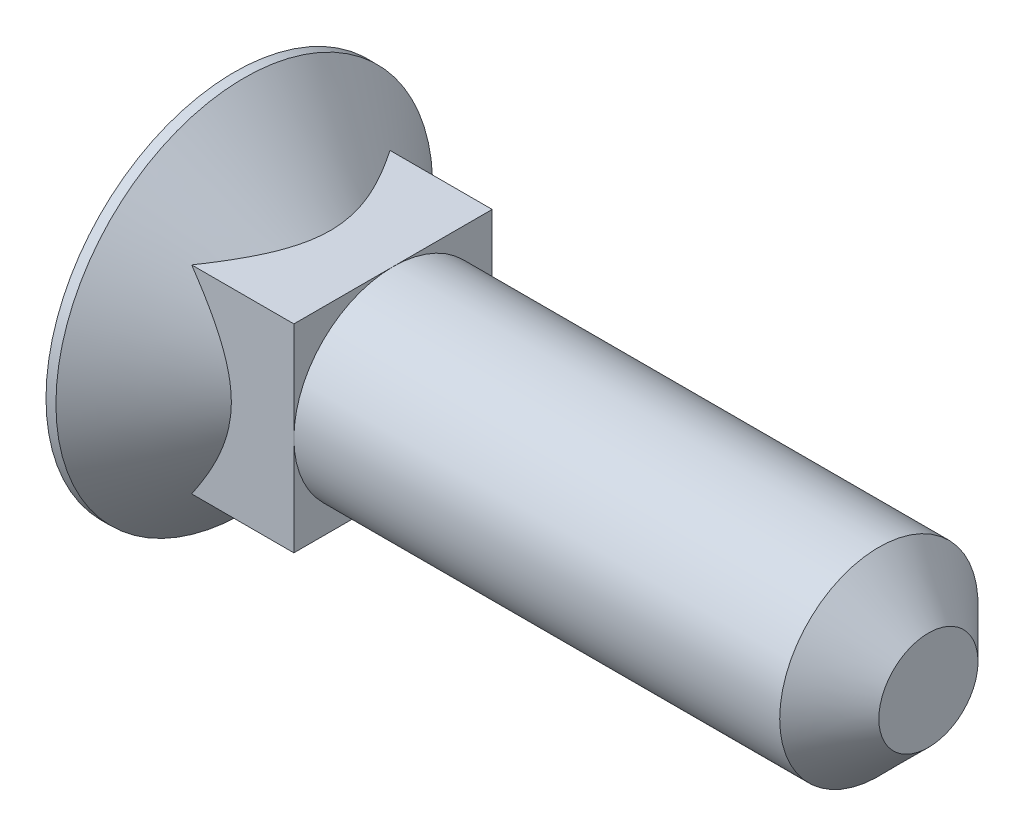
SolidWorks part; units mm, degrees
ref_plane "Front Plane" through (0, 0, 0) normal (0, 0, 1) x (1, 0, 0)
ref_plane "Top Plane" through (0, 0, 0) normal (0, 1, 0) x (1, 0, 0)
ref_plane "Right Plane" through (0, 0, 0) normal (1, 0, 0) x (0, 0, -1)
other "Configuration Table"
sketch "BodySke" plane through (0, 0, 0) normal (0, 0, 1) x (1, 0, 0)
  line L0 (0, 0) -> (44.1549, 0) construction
  line L1 (0, 0) -> (0, 9.5)
  line L2 (0, 9.5) -> (0.5, 9.5)
  line L3 (0.5, 9.5) -> (4.8456, 5)
  line L4 (4.8456, 5) -> (32.5, 5)
  line L5 (32.5, 5) -> (35, 2.5)
  line L6 (35, 2.5) -> (35, 0)
  line L7 (35, 0) -> (0, 0)
  line L8 (0, -9.5) -> (0.5, -9.5) construction
  line L9 (0.5, -9.5) -> (4.8456, -5) construction
  line L10 (8, 5) -> (8, 0) construction
  line L11 (33.5, 0) -> (33.5, 5) construction
  point P16 (0, 4.172)
revolve "BaseBody" add sketch "BodySke" angle 360 about L0
sketch "SquareSke" plane through (0, 0, 0) normal (1, 0, 0) x (0, 0, -1)
  line L0 (-5, 5) -> (5, -5) construction
  line L1 (-5, 5) -> (5, 5)
  line L2 (-5, 5) -> (-5, -5)
  line L3 (-5, -5) -> (5, -5)
  line L4 (5, 5) -> (5, -5)
extrude "Square" add sketch "SquareSke" along normal blind 8
sketch "ThdSchSke" plane through (0, 0, 0) normal (0, 0, 1) x (1, 0, 0)
  line L0 (0, 0) -> (40.6405, 0) construction
  line L1 (0, 9.5) -> (0, -9.5) construction
  line L2 (31, 5.9561) -> (31, 5)
  line L3 (31, 5.9561) -> (31.9561, 5.9561)
  line L4 (31.9561, 5.9561) -> (31.9561, 5)
  line L5 (31.9561, 5) -> (31.478, 4.172)
  line L6 (31.478, 4.172) -> (31, 5)
  line L8 (4.8456, 5) -> (32.5, 5) construction
revolve "ThreadSchematic" [suppressed] cut sketch "ThdSchSke" angle 360 about L0
pattern_linear "ThdSchPat" [suppressed]
equation "\"Thread_minor@ThreadCosmetic\" = \"Thread_minor@BodySke\""
equation "\"D1@ThdSchSke\" = \"Advance@BodySke\""
equation "\"Advance@ThdSchPat\" = \"Advance@BodySke\""
equation "\"Teeth_Num@ThdSchPat\" =  int( (  \"Thread_length@BodySke\"  - \"Depth_Chamfer@BodySke\" ) / \"Advance@BodySke\" )"
equation "\"D1@SquareSke\" = \"Diameter@BodySke\""
